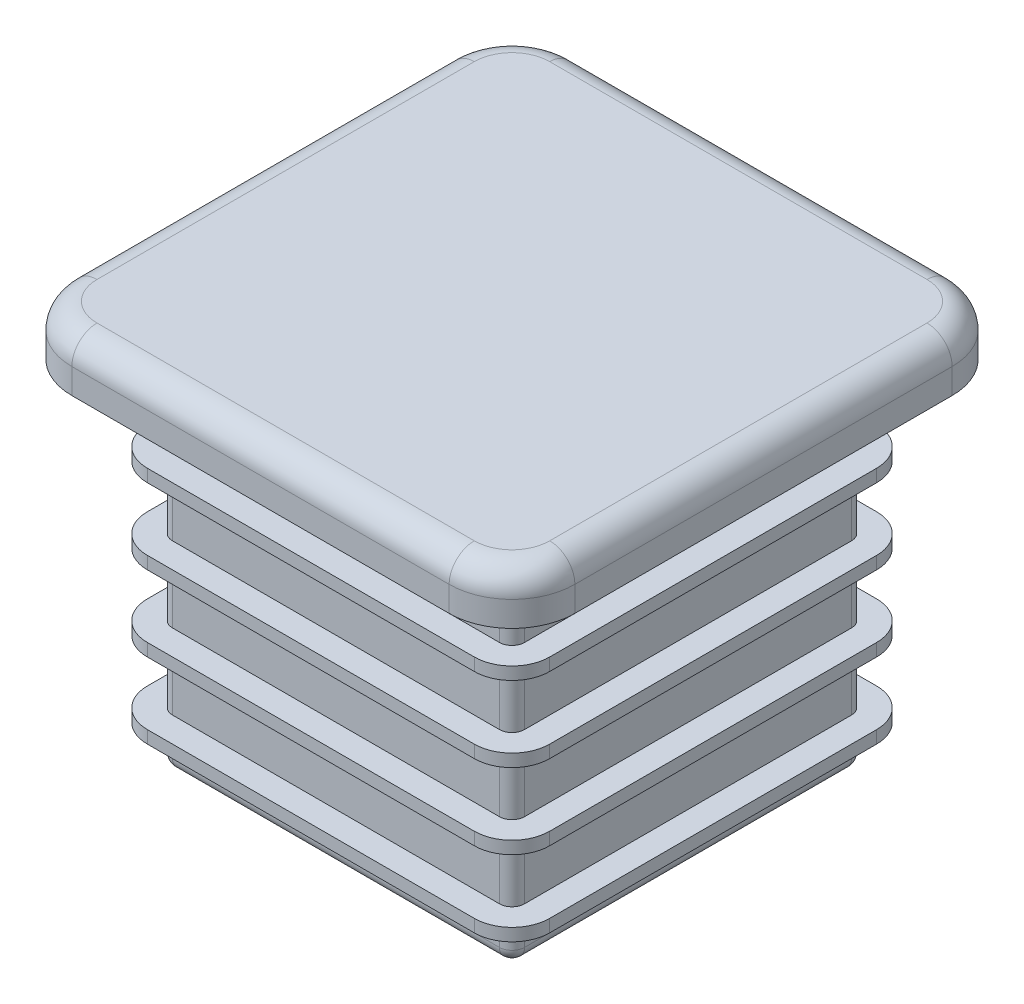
SolidWorks part; units mm, degrees
ref_plane "Plan de face" through (0, 0, 0) normal (0, 0, 1) x (1, 0, 0)
ref_plane "Plan de dessus" through (0, 0, 0) normal (0, 1, 0) x (1, 0, 0)
ref_plane "Plan de droite" through (0, 0, 0) normal (1, 0, 0) x (0, 0, -1)
sketch "Esquisse1" plane through (0, 0, 0) normal (0, 1, 0) x (1, 0, 0)
  line L1 (-7.5, 10) -> (7.5, 10)
  line L2 (-10, 7.5) -> (-10, -7.5)
  line L3 (-7.5, -10) -> (7.5, -10)
  line L4 (10, 7.5) -> (10, -7.5)
  line L5 (-10, 10) -> (10, -10) construction
  line L6 (-10, -10) -> (10, 10) construction
  arc A0 (-10, -7.5) -> (-7.5, -10) centre (-7.5, -7.5) ccw
  arc A1 (7.5, -10) -> (10, -7.5) centre (7.5, -7.5) ccw
  arc A2 (7.5, 10) -> (10, 7.5) centre (7.5, 7.5) cw
  arc A3 (-7.5, 10) -> (-10, 7.5) centre (-7.5, 7.5) ccw
  point P0 (0, 0)
  dimension "D2" = 2.5
  dimension "D1" = 20
extrude "Boss.-Extru.1" add sketch "Esquisse1" along normal blind 2
fillet "Congé1" radius 1 8 edges at (-9.2678, 2, 9.2678) (-10, 2, 0) (-9.2678, 2, -9.2678) (0, 2, -10) (9.2678, 2, -9.2678) (10, 2, 0) (9.2678, 2, 9.2678) (0, 2, 10)
sketch "Esquisse2" plane through (0, 0, 0) normal (0, -1, 0) x (1, 0, 0)
  line L1 (-7, 7) -> (7, 7)
  line L2 (-7, 7) -> (-7, -7)
  line L3 (-7, -7) -> (7, -7)
  line L4 (7, 7) -> (7, -7)
  line L5 (-7, 7) -> (7, -7) construction
  line L6 (-7, -7) -> (7, 7) construction
  point P0 (0, 0)
  dimension "D1" = 14
extrude "Extru.-Mince1" add sketch "Esquisse2" along normal blind 14 thin
fillet "Congé2" radius 0.5 4 edges at (-7, -7, 7) (-7, -7, -7) (7, -7, 7) (7, -7, -7)
fillet "Congé3" radius 0.5 8 edges at (-6.8536, -14, 6.8536) (0, -14, 7) (6.8536, -14, 6.8536) (7, -14, 0) (6.8536, -14, -6.8536) (0, -14, -7) (-6.8536, -14, -6.8536) (-7, -14, 0)
ref_plane "Plan1" through (0, -3, 0) normal (0, -1, 0) x (-1, 0, 0)
sketch "Esquisse3" plane through (0, -3, 0) normal (0, -1, 0) x (-1, 0, 0)
  line L0 (7, -6.5) -> (7, 6.5) construction
  line L1 (-6.5, -7) -> (6.5, -7) construction
  line L2 (-7, 6.5) -> (-7, -6.5) construction
  line L3 (6.5, 7) -> (-6.5, 7) construction
  line L4 (7, -6.5) -> (7, 6.5)
  line L5 (-6.5, -7) -> (6.5, -7)
  line L6 (-7, 6.5) -> (-7, -6.5)
  line L7 (6.5, 7) -> (-6.5, 7)
  line L8 (8, -6.5) -> (8, 6.5)
  line L9 (6.5, 8) -> (-6.5, 8)
  line L10 (-8, 6.5) -> (-8, -6.5)
  line L11 (-6.5, -8) -> (6.5, -8)
  arc A0 (6.5, -7) -> (7, -6.5) centre (6.5, -6.5) ccw construction
  arc A1 (-7, -6.5) -> (-6.5, -7) centre (-6.5, -6.5) ccw construction
  arc A2 (-6.5, 7) -> (-7, 6.5) centre (-6.5, 6.5) ccw construction
  arc A3 (7, 6.5) -> (6.5, 7) centre (6.5, 6.5) ccw construction
  arc A4 (6.5, -7) -> (7, -6.5) centre (6.5, -6.5) ccw
  arc A5 (-7, -6.5) -> (-6.5, -7) centre (-6.5, -6.5) ccw
  arc A6 (-6.5, 7) -> (-7, 6.5) centre (-6.5, 6.5) ccw
  arc A7 (7, 6.5) -> (6.5, 7) centre (6.5, 6.5) ccw
  arc A8 (8, 6.5) -> (6.5, 8) centre (6.5, 6.5) ccw
  arc A9 (-6.5, 8) -> (-8, 6.5) centre (-6.5, 6.5) ccw
  arc A10 (-8, -6.5) -> (-6.5, -8) centre (-6.5, -6.5) ccw
  arc A11 (6.5, -8) -> (8, -6.5) centre (6.5, -6.5) ccw
  dimension "D1" = 1
extrude "Boss.-Extru.2" add sketch "Esquisse3" along normal blind 0.5
pattern_linear "Répétition linéaire1" count 4 spacing 3 along (0, -1, 0) of "Boss.-Extru.2"
